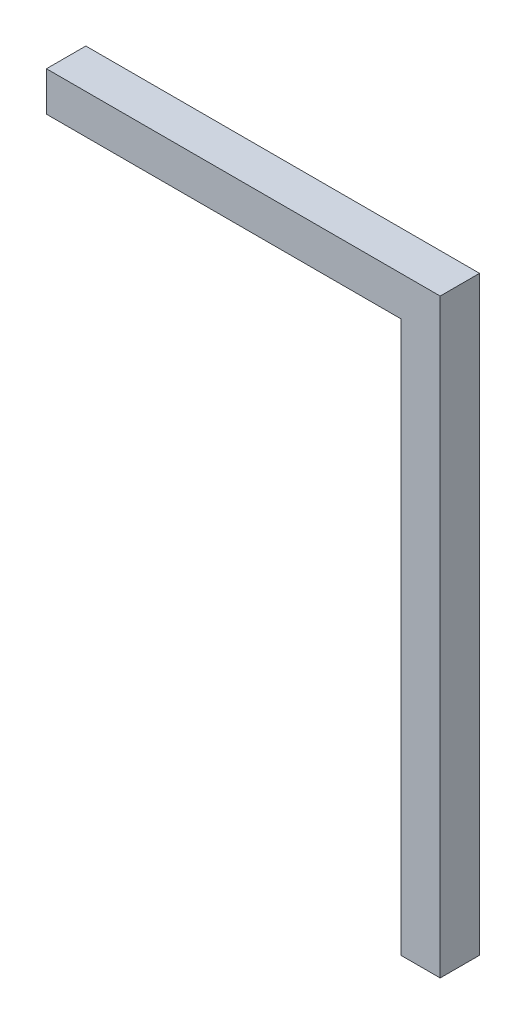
SolidWorks part; units mm, degrees
ref_plane "Plan de face" through (0, 0, 0) normal (0, 0, 1) x (1, 0, 0)
ref_plane "Plan de dessus" through (0, 0, 0) normal (0, 1, 0) x (1, 0, 0)
ref_plane "Plan de droite" through (0, 0, 0) normal (1, 0, 0) x (0, 0, -1)
sketch "Esquisse1" plane through (0, 0, 0) normal (0, 0, 1) x (1, 0, 0)
  line L0 (-100, 0) -> (0, 0)
  line L1 (0, 0) -> (0, -150)
  dimension "D1" = 100
  dimension "D2" = 150
extrude "Extru.-Mince1" add sketch "Esquisse1" along normal blind 10 thin
